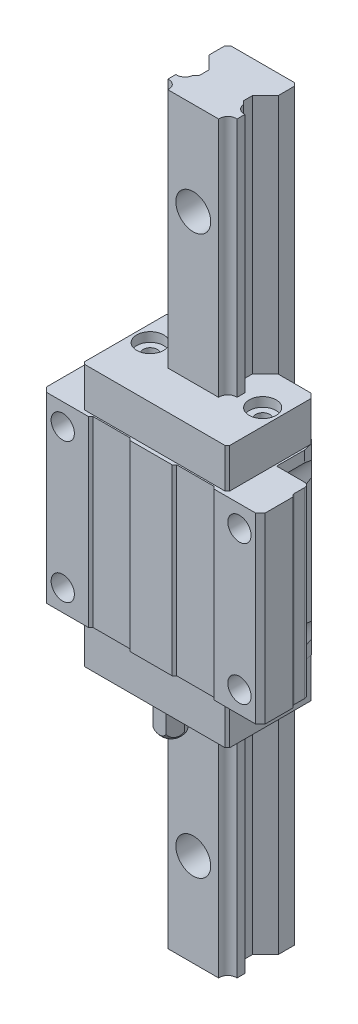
SolidWorks part; units mm, degrees
ref_plane "Front Plane" through (0, 0, 0) normal (0, 0, 1) x (1, 0, 0)
ref_plane "Top Plane" through (0, 0, 0) normal (0, 1, 0) x (1, 0, 0)
ref_plane "Right Plane" through (0, 0, 0) normal (1, 0, 0) x (0, 0, -1)
imported_body "Imported3"
sketch "Sketch8" plane through (0, -48.4166, 0) normal (0, 1, 0) x (-1, 0, 0)
  line L0 (-2.8868, -4.1502) -> (-1.4434, -1.6502)
  line L1 (-1.4434, -1.6502) -> (1.4434, -1.6502)
  line L2 (1.4434, -1.6502) -> (2.8868, -4.1502)
  line L3 (2.8868, -4.1502) -> (1.4434, -6.6502)
  line L4 (1.4434, -6.6502) -> (-1.4434, -6.6502)
  line L5 (-1.4434, -6.6502) -> (-2.8868, -4.1502)
extrude "Boss-Extrude4" add sketch "Sketch8" along normal blind 4.8165
ref_plane "Plane2" through (0, -95.4501, 0) normal (0, -1, 0) x (1, 0, 0)
sketch "Sketch12" plane through (0, -95.4501, 0) normal (0, -1, 0) x (1, 0, 0)
  line L0 (-4.73, -15.0209) -> (-4.73, -23.8499)
  line L1 (-4.73, -23.8499) -> (4.73, -23.8499)
  line L2 (4.73, -23.8499) -> (4.73, -15.0209)
  line L3 (4.73, -15.0209) -> (5.4472, -14.3037)
  line L4 (7.43, -12.6044) -> (7.43, -8.9199)
  line L5 (7.43, -8.9199) -> (-7.43, -8.9199)
  line L6 (-7.43, -8.9199) -> (-7.43, -12.6044)
  line L7 (-5.4472, -14.3037) -> (-4.73, -15.0209)
  arc A0 (5.4472, -14.3037) -> (7.43, -12.6044) centre (7.2449, -14.3948) cw
  arc A1 (-7.43, -12.6044) -> (-5.4472, -14.3037) centre (-7.2449, -14.3948) cw
extrude "Boss-Extrude5" add sketch "Sketch12" against normal blind 160 separate body
sketch "Sketch13" plane through (-4.73, 0, 0) normal (-1, 0, 0) x (0, 0, 1)
  line L0 (-23.8499, 64.5499) -> (-19.7489, 64.5499)
  line L1 (-19.7489, 64.5499) -> (-19.7489, -95.4501)
  line L2 (-19.7489, -95.4501) -> (-23.8499, -95.4501)
  line L3 (-23.8499, -95.4501) -> (-23.8499, 64.5499)
extrude "Boss-Extrude6" add sketch "Sketch13" along normal blind 2.77
sketch "Sketch14" plane through (4.73, 0, 0) normal (1, 0, 0) x (0, 0, -1)
  line L0 (23.8499, -95.4501) -> (19.7489, -95.4501)
  line L1 (19.7489, -95.4501) -> (19.7489, 64.5499)
  line L2 (19.7489, 64.5499) -> (23.8499, 64.5499)
  line L3 (23.8499, 64.5499) -> (23.8499, -95.4501)
extrude "Boss-Extrude7" add sketch "Sketch14" along normal blind 2.77
draft "Draft3" type of draft neutral plane draft angle 45 faces to draft 1 parameters "D1"=45
draft "Draft4" type of draft neutral plane draft angle 45 faces to draft 1 parameters "D1"=45
hole_wizard "Ø3.6 (3.6) Diameter Hole2" positions "Sketch16" profile "Sketch15" hole size "Ø3.6" standard "Ansi Metric"
sketch "Sketch16" plane through (0, 64.5499, 0) normal (0, 1, 0) x (-1, 0, 0)
  point P0 (7.2449, -9.105)
  point P1 (-7.2449, -9.105)
sketch "Sketch15" plane through (-7.2449, 64.5499, -9.105) normal (1, 0, 0) x (0, 0, 1)
  line L0 (0, 0) -> (0, 160)
  line L1 (0, 160) -> (1.8, 160)
  line L2 (1.8, 160) -> (1.8, 0)
  line L5 (1.8, 0) -> (0, 0)
  line L11 (0, -6.35) -> (0, 107.95) construction
  dimension "Thru Hole Dia." = 3.6
  dimension "Thru Hole Depth" = 160
hole_wizard "CBORE for M4 Hex Head Machine Screw2" positions "Sketch18" profile "Sketch17" counterbore size "M4" standard "Ansi Metric"
sketch "Sketch18" plane through (0, 0, -8.9199) normal (0, 0, 1) x (1, 0, 0)
  point P0 (0, 44.5499)
  point P1 (0, -15.4501)
  point P2 (0, -75.4501)
sketch "Sketch17" plane through (0, 44.5499, -8.9199) normal (1, 0, 0) x (0, -1, 0)
  line L0 (0, 0) -> (0, 14.93)
  line L1 (0, 14.93) -> (2.25, 14.93)
  line L3 (2.25, 14.93) -> (2.25, 5.3)
  line L4 (2.25, 5.3) -> (3.75, 5.3)
  line L5 (3.75, 5.3) -> (3.75, 0)
  line L7 (3.75, 0) -> (0, 0)
  line L11 (0, -6.35) -> (0, 107.95) construction
  dimension "Thru Hole Dia." = 4.5
  dimension "Thru Hole Depth" = 14.93
  dimension "C'Bore Dia." = 7.5
  dimension "C'Bore Depth" = 5.3
chamfer "Chamfer3" distance 0.7 angle 45 2 edges at (7.5, -15.4501, -23.8499) (-7.5, -15.4501, -23.8499)
imported_body "Imported4"
